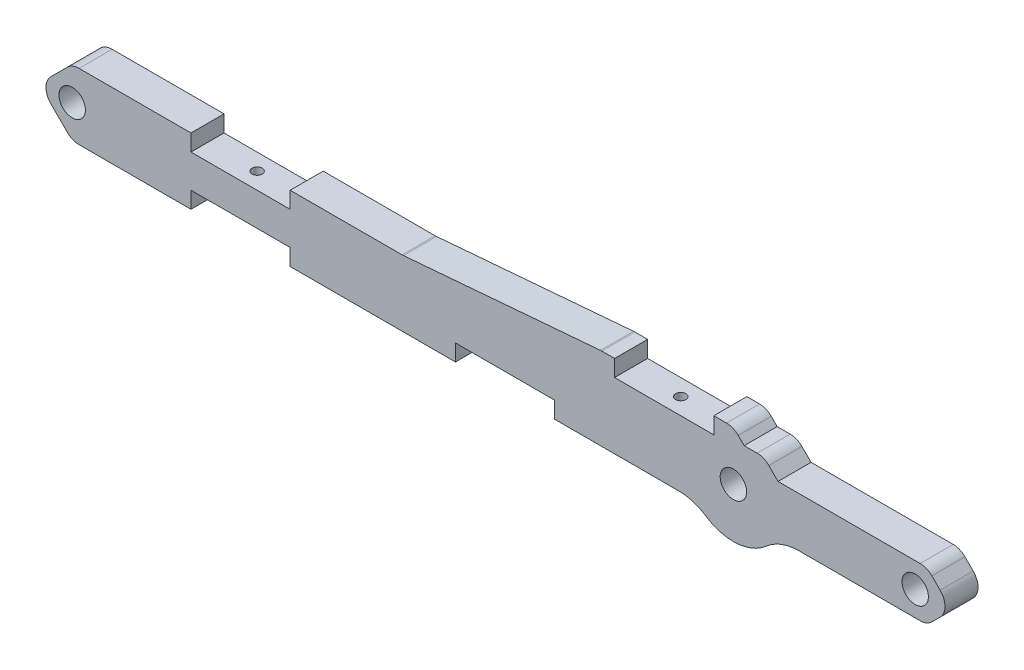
SolidWorks part; units mm, degrees
ref_plane "Alzado" through (0, 0, 0) normal (0, 0, 1) x (1, 0, 0)
ref_plane "Planta" through (0, 0, 0) normal (0, 1, 0) x (1, 0, 0)
ref_plane "Vista lateral" through (0, 0, 0) normal (1, 0, 0) x (0, 0, -1)
sketch "Croquis1" plane through (0, 0, 0) normal (0, 0, 1) x (1, 0, 0)
  line L1 (-40, 15) -> (0, 15)
  line L2 (0, 15) -> (3.2574, 11.7426)
  line L8 (-40, 15) -> (-100, 10)
  line L9 (-100, 10) -> (-200, 10)
  line L11 (0, 0) -> (15, 0) construction
  line L12 (0, 15) -> (0, 0) construction
  line L13 (0, -15) -> (0, 0) construction
  line L14 (-200, 10) -> (-210, 0)
  line L15 (-210, 0) -> (-200, -10)
  line L17 (13.5, 7.5) -> (58.5711, 7.5)
  line L26 (3.2574, 11.7426) -> (9.2574, 11.7426)
  line L27 (19.8431, -7.5) -> (58.5711, -7.5)
  line L28 (58.5711, -7.5) -> (62.5355, -3.5355)
  line L29 (58.5711, 7.5) -> (62.5355, 3.5355)
  line L30 (55, 0) -> (55, 7.5) construction
  line L31 (55, 0) -> (55, -7.5) construction
  line L32 (51, 4) -> (59, 4) construction
  line L33 (51, 4) -> (51, -4) construction
  line L34 (51, -4) -> (59, -4) construction
  line L35 (59, 4) -> (59, -4) construction
  line L36 (51, 4) -> (59, -4) construction
  line L37 (51, -4) -> (59, 4) construction
  line L38 (9.2574, 11.7426) -> (13.5, 7.5)
  line L39 (-200, -10) -> (-16.5831, -10)
  circle A0 centre (0, 0) radius 4
  circle A1 centre (55, 0) radius 4
  circle A2 centre (-200, 0) radius 4
  arc A3 (9.9216, -11.25) -> (-8.2916, -12.5) centre (0, 0) cw
  arc A4 (62.5355, 3.5355) -> (62.5355, -3.5355) centre (59, 0) cw
  arc A5 (9.9216, -11.25) -> (19.8431, -7.5) centre (19.8431, -22.5) cw
  arc A7 (-16.5831, -10) -> (-8.2916, -12.5) centre (-16.5831, -25) cw
  point P27 (0, 0)
  point P35 (0, 0)
  point P36 (0, 0)
  point P37 (0, 0)
  dimension "D1" = 8
  dimension "D2" = 8
  dimension "D3" = 15
  dimension "D7" = 3.5
  dimension "D17" = 5
  dimension "D4" = 40
  dimension "D5" = 60
  dimension "D6" = 15
  dimension "D8" = 135
  dimension "D10" = 55
  dimension "D11" = 45
  dimension "D12" = 210
  dimension "D13" = 45
  dimension "D14" = 6
  dimension "D15" = 200
extrude "Saliente-Extruir1" add sketch "Croquis1" along normal mid plane 10
fillet "Redondeo1" radius 5 9 edges at (58.5711, 7.5, 0) (0, 15, 0) (-40, 15, 0) (-100, 10, 0) (-200, 10, 0) (-210, 0, 0) (-200, -10, 0) (9.2574, 11.7426, 0) (58.5711, -7.5, 0)
sketch "Croquis2" plane through (0, 15, 0) normal (0, 1, 0) x (1, 0, 0)
  line L0 (-2.0711, -5) -> (-39.792, -5) construction
  line L1 (-2.0711, -5) -> (-39.792, -5) construction
  line L2 (-2.0711, 5) -> (-39.792, 5) construction
  line L3 (-5.9315, -5) -> (-35.9315, -5)
  line L4 (-5.9315, -5) -> (-5.9315, 5)
  line L5 (-5.9315, 5) -> (-35.9315, 5)
  line L6 (-35.9315, -5) -> (-35.9315, 5)
  line L7 (-20.9315, -5) -> (-20.9315, 5) construction
  dimension "D1" = 10
  dimension "D2" = 30
extrude "Cortar-Extruir1" cut sketch "Croquis2" against normal blind 5
sketch "Croquis3" plane through (0, 10, 0) normal (0, 1, 0) x (1, 0, 0)
  line L0 (-149.0685, 5) -> (-149.0685, -5) construction
  line L6 (-100.208, 5) -> (-197.9289, 5) construction
  line L7 (-134.0685, 5) -> (-164.0685, 5)
  line L8 (-134.0685, 5) -> (-134.0685, -5)
  line L9 (-134.0685, -5) -> (-164.0685, -5)
  line L10 (-164.0685, 5) -> (-164.0685, -5)
  line L12 (-100.208, -5) -> (-197.9289, -5) construction
  dimension "D1" = 30
extrude "Cortar-Extruir2" cut sketch "Croquis3" against normal blind 5
sketch "Croquis5" plane through (0, -10, 0) normal (0, -1, 0) x (1, 0, 0)
  line L1 (-84.0685, 5) -> (-54.0685, 5)
  line L2 (-84.0685, 5) -> (-84.0685, -5)
  line L3 (-84.0685, -5) -> (-54.0685, -5)
  line L4 (-134.0685, -5) -> (-134.0685, 5)
  line L5 (-164.0685, -5) -> (-134.0685, -5)
  line L6 (-164.0685, 5) -> (-164.0685, -5)
  line L7 (-134.0685, 5) -> (-164.0685, 5)
  line L8 (-134.0685, -5) -> (-134.0685, 5)
  line L9 (-164.0685, -5) -> (-134.0685, -5)
  line L10 (-164.0685, 5) -> (-164.0685, -5)
  line L11 (-134.0685, 5) -> (-164.0685, 5)
  line L12 (-54.0685, 5) -> (-54.0685, -5)
  dimension "D2" = 50
  dimension "D1" = 0
extrude "Cortar-Extruir3" cut sketch "Croquis5" against normal blind 5
sketch "Croquis6" plane through (0, -5, 0) normal (0, -1, 0) x (1, 0, 0)
  line L0 (-164.0685, 5) -> (-134.0685, -5) construction
  line L1 (-84.0685, 5) -> (-54.0685, -5) construction
  line L2 (-164.0685, -5) -> (-164.0685, 5) construction
  circle A0 centre (-149.0685, 0) radius 1.55
  circle A1 centre (-69.0685, 0) radius 1.55
  dimension "D1" = 3.1
extrude "Cortar-Extruir4" cut sketch "Croquis6" against normal up to surface (10 mm away)
sketch "Croquis7" plane through (0, 10, 0) normal (0, 1, 0) x (1, 0, 0)
  line L0 (-35.9315, 5) -> (-5.9315, -5) construction
  circle A0 centre (-20.9315, 0) radius 1.55
  dimension "D1" = 3.1
extrude "Cortar-Extruir5" cut sketch "Croquis7" against normal up to surface (15 mm away)
